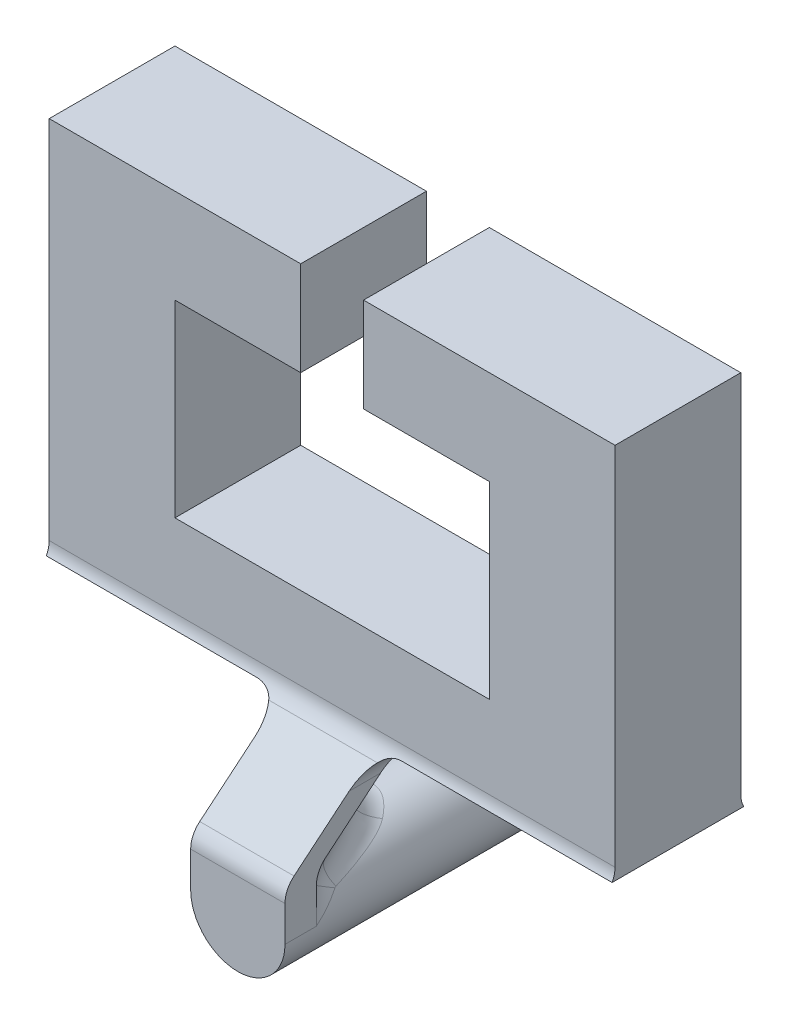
SolidWorks part; units mm, degrees
ref_plane "Front Plane" through (0, 0, 0) normal (0, 0, 1) x (1, 0, 0)
ref_plane "Top Plane" through (0, 0, 0) normal (0, 1, 0) x (1, 0, 0)
ref_plane "Right Plane" through (0, 0, 0) normal (1, 0, 0) x (0, 0, -1)
sketch "Sketch1" plane through (0, 0, 0) normal (0, 0, 1) x (1, 0, 0)
  line L0 (57.15, 0) -> (57.15, 76.2) construction
  line L1 (0, 0) -> (114.3, 0)
  line L2 (0, 0) -> (0, 76.2)
  line L3 (0, 76.2) -> (114.3, 76.2)
  line L4 (114.3, 0) -> (114.3, 76.2)
extrude "Boss-Extrude1" add sketch "Sketch1" along normal blind 25.4
sketch "Sketch4" plane through (0, 0, 25.4) normal (0, 0, 1) x (1, 0, 0)
  line L0 (63.5, 76.2) -> (50.8, 76.2)
  line L1 (0, 76.2) -> (114.3, 76.2) construction
  line L2 (50.8, 76.2) -> (50.8, 57.15)
  line L3 (50.8, 57.15) -> (25.4, 57.15)
  line L4 (25.4, 57.15) -> (25.4, 19.05)
  line L5 (25.4, 19.05) -> (88.9, 19.05)
  line L6 (88.9, 19.05) -> (88.9, 57.15)
  line L7 (88.9, 57.15) -> (63.5, 57.15)
  line L8 (63.5, 57.15) -> (63.5, 76.2)
  point P5 (57.15, 76.2)
extrude "Cut-Extrude1" cut sketch "Sketch4" against normal up to next
sketch3d "3DSketch2" plane through (0, 0, 0) normal (0, 0, 1) x (1, 0, 0)
  dimension "D1" = 12.7
sketch "Sketch5" plane through (0, 0, 12.7) normal (0, 0, 1) x (1, 0, 0)
  line L0 (53.975, 0) -> (60.325, 0)
  line L2 (0, 0) -> (114.3, 0) construction
  line L3 (60.325, 0) -> (60.325, -16.4197)
  line L4 (53.975, 0) -> (53.975, -16.4197)
  arc A1 (60.325, -16.4197) -> (53.975, -16.4197) centre (57.15, -25.4) ccw
  circle A2 centre (57.15, -25.4) radius 9.525
  point P4 (57.15, 0)
extrude "Boss-Extrude2" add sketch "Sketch5" along normal mid plane 63.5 separate body contours A2
ref_plane "Plane3" through (57.15, 0, 0) normal (-1, 0, 0) x (0, 0, 1)
sketch "Sketch6" plane through (57.15, 0, 0) normal (-1, 0, 0) x (0, 0, 1)
  line L0 (0, 0) -> (-19.05, -15.875)
  line L1 (25.4, 0) -> (44.45, -15.875)
  line L2 (-19.05, -15.875) -> (-12.7, -15.875)
  line L3 (44.45, -15.875) -> (-19.05, -15.875) construction
  line L4 (-12.7, -15.875) -> (6.35, 0)
  line L5 (25.4, 0) -> (0, 0) construction
  line L6 (44.45, -15.875) -> (38.1, -15.875)
  line L7 (38.1, -15.875) -> (19.05, 0)
  line L8 (6.35, 0) -> (0, 0)
  line L9 (19.05, 0) -> (25.4, 0)
extrude "Boss-Extrude3" add sketch "Sketch6" along normal mid plane 19.05
ref_plane "Plane4" through (47.625, -15.875, -19.05) normal (0, 0, 1) x (1, 0, 0)
sketch "Sketch13" plane through (0, -15.875, 0) normal (0, -1, 0) x (1, 0, 0)
  line L1 (47.625, 44.45) -> (66.675, 44.45)
  line L2 (47.625, 44.45) -> (47.625, 38.1)
  line L3 (47.625, 38.1) -> (66.675, 38.1)
  line L4 (66.675, 44.45) -> (66.675, 38.1)
  line L6 (66.675, 38.1) -> (66.675, 44.45) construction
  line L7 (66.675, -19.05) -> (66.675, 44.45) construction
  line L9 (66.675, -19.05) -> (47.625, -19.05)
  line L10 (66.675, -19.05) -> (66.675, -12.7)
  line L11 (66.675, -12.7) -> (47.625, -12.7)
  line L12 (47.625, -19.05) -> (47.625, -12.7)
  line L13 (47.625, 44.45) -> (47.625, -19.05) construction
extrude "Boss-Extrude4" add sketch "Sketch13" along normal blind 9.525
fillet "Fillet2" radius 5.08 14 edges at (57.15, 0, 19.05) (57.15, 0, 6.35) (47.625, 0, 3.175) (66.675, 0, 3.175) (47.625, 0, 22.225) (66.675, 0, 22.225) (61.9125, -15.875, 38.1) (52.3875, -15.875, 38.1) (52.3875, -15.875, -12.7) (61.9125, -15.875, -12.7) (57.15, 0, 25.4) (57.15, -15.875, 44.45) (57.15, -15.875, -19.05) (57.15, 0, 0)
fillet "Fillet4" radius 7.62 4 edges at (65.8309, -21.4797, -12.7) (65.8309, -21.4797, 38.1) (48.4691, -21.4797, -12.7) (48.4691, -21.4797, 38.1)
equation "\"D4@Sketch13\"=\"A\""
equation "\"D3@Sketch13\"=\"B\""
equation "\"D2@Sketch13\"=\"A\""
equation "\"D1@Sketch13\"=\"B\""
equation "\"D2@Sketch6\"=\"B\""
equation "\"D1@Sketch6\"=\"B\""
equation "\"D1@Sketch1\"=\"BodyHeight\""
equation "\"A\"= .750in"
equation "\"B\"= .250in"
equation "\"C\"= .750in"
equation "\"D\"= 1in"
equation "\"E\"=0.75"
equation "\"OW\"= 4.5in"
equation "\"PL\"= 2.50in"
equation "\"Slot\"= 0.5in"
equation "\"PocketWidth\"= 2.5in"
equation "\"PocketHeight\"= 1.5in"
equation "\"BodyHeight\"= \"C\" + \"PocketHeight\" + \"E\""
equation "\"ConnectorDepth\"= 0.5in"
equation "\"PinDrop\"= 1in"
equation "\"D2@Sketch1\"=\"OW\""
equation "\"D1@Boss-Extrude1\"=\"D\""
equation "\"D1@Sketch4\"=\"A\""
equation "\"D2@Sketch4\"=\"PL\""
equation "\"D3@Sketch4\"=\"PocketHeight\""
equation "\"D1@Sketch5\"=\"B\""
equation "\"D2@Sketch5\"=\"PinDrop\""
equation "\"D3@Sketch5\"=\"A\""
equation "\"D1@Boss-Extrude3\"=\"A\""
equation "\"D1@Boss-Extrude2\"=\"Slot\""
